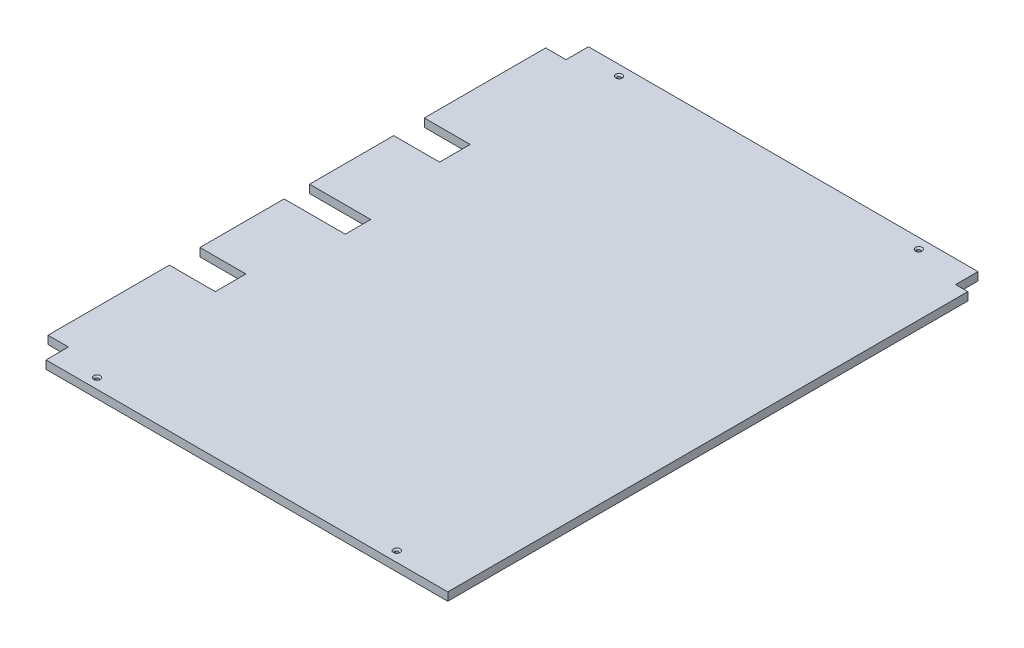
SolidWorks part; units mm, degrees
ref_plane "Ebene vorne" through (0, 0, 0) normal (0, 0, 1) x (1, 0, 0)
ref_plane "Ebene oben" through (0, 0, 0) normal (0, 1, 0) x (1, 0, 0)
ref_plane "Ebene rechts" through (0, 0, 0) normal (1, 0, 0) x (0, 0, -1)
sketch "Skizze1" plane through (0, 0, 0) normal (0, 1, 0) x (1, 0, 0)
  line L1 (-207, -266) -> (207, -266)
  line L2 (-207, -266) -> (-207, 266)
  line L3 (-207, 266) -> (207, 266)
  line L4 (207, -266) -> (207, 266)
  line L5 (-207, -266) -> (207, 266) construction
  line L6 (-207, 266) -> (207, -266) construction
  point P0 (0, 0)
  dimension "D1" = 414
  dimension "D2" = 532
extrude "Aufsatz-Linear austragen1" add sketch "Skizze1" along normal blind 8
sketch "Skizze2" plane through (0, 8, 0) normal (0, 1, 0) x (1, 0, 0)
  line L1 (-207, -266) -> (-187, -266)
  line L2 (-207, -266) -> (-207, -244)
  line L3 (-207, -244) -> (-187, -244)
  line L4 (-187, -266) -> (-187, -244)
  line L5 (-207, 266) -> (-187, 266)
  line L6 (-207, 266) -> (-207, 244)
  line L7 (-207, 244) -> (-187, 244)
  line L8 (-187, 266) -> (-187, 244)
  line L9 (207, 266) -> (195, 266)
  line L10 (207, 266) -> (207, 244)
  line L11 (207, 244) -> (195, 244)
  line L12 (195, 266) -> (195, 244)
  dimension "D1" = 20
  dimension "D2" = 22
  dimension "D3" = 22
  dimension "D4" = 20
  dimension "D5" = 12
extrude "Schnitt-Linear austragen1" cut sketch "Skizze2" against normal through all
sketch "Skizze3" plane through (0, 8, 0) normal (0, 1, 0) x (1, 0, 0)
  line L0 (-207, 244) -> (-207, -244) construction
  line L1 (-207, 125) -> (-162, 125)
  line L2 (-207, 125) -> (-207, 95)
  line L3 (-207, 95) -> (-162, 95)
  line L4 (-162, 125) -> (-162, 95)
  line L5 (-147, 0) -> (0, 0) construction
  line L6 (-207, -95) -> (-162, -95)
  line L7 (-207, -95) -> (-207, -125)
  line L8 (-207, -125) -> (-162, -125)
  line L9 (-162, -95) -> (-162, -125)
  line L11 (-207, 12.5) -> (-207, -12.5)
  line L14 (-147, 12.5) -> (-207, 12.5)
  line L15 (-147, -12.5) -> (-207, -12.5)
  line L16 (-147, 12.5) -> (-147, -12.5)
  point P14 (-162, -110)
  point P16 (-162, 110)
  point P20 (-147, 0)
  dimension "D1" = 60
  dimension "D2" = 30
  dimension "D3" = 110
  dimension "D4" = 110
  dimension "D5" = 45
  dimension "D6" = 25
extrude "Schnitt-Linear austragen2" cut sketch "Skizze3" against normal through all
hole_wizard "Ø3.5 (3.5) Durchmesser Bohrung1" positions "Skizze4" profile "Skizze5" hole size "Ø3.5" standard "DIN"
sketch "Skizze4" plane through (0, 8, 0) normal (0, 1, 0) x (1, 0, 0)
  line L0 (195, 266) -> (-187, 266) construction
  line L1 (-187, -266) -> (207, -266) construction
  line L2 (207, -266) -> (207, 244) construction
  line L3 (-207, -125) -> (-207, -244) construction
  point P0 (-147, -256)
  point P2 (147, -256)
  point P4 (147, 256)
  point P6 (-147, 256)
  dimension "D1" = 10
  dimension "D2" = 10
  dimension "D3" = 60
  dimension "D4" = 60
sketch "Skizze5" plane through (-147, 8, 256) normal (1, 0, 0) x (0, 0, 1)
  line L0 (0, 0) -> (0, 8)
  line L1 (0, 8) -> (1.75, 8)
  line L2 (1.75, 8) -> (1.75, 0)
  line L5 (1.75, 0) -> (0, 0)
  line L11 (0, -6.35) -> (0, 107.95) construction
  dimension "Bohrerdurchmesser" = 3.5
  dimension "Bohrungstiefe" = 8
chamfer "Fase1" distance 1.5 angle 45 4 edges at (147, 8, -254.25) (-147, 8, -254.25) (-147, 8, 257.75) (147, 8, 257.75)
